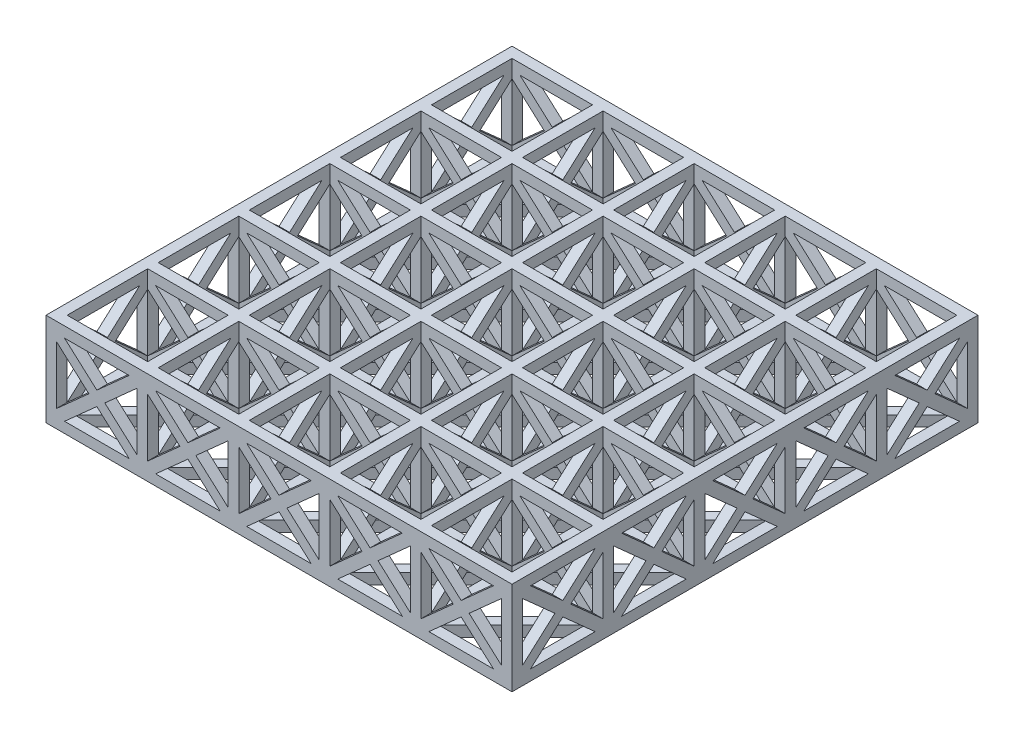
SolidWorks part; units mm, degrees
ref_plane "Front Plane" through (0, 0, 0) normal (0, 0, 1) x (1, 0, 0)
ref_plane "Top Plane" through (0, 0, 0) normal (0, 1, 0) x (1, 0, 0)
ref_plane "Right Plane" through (0, 0, 0) normal (1, 0, 0) x (0, 0, -1)
sketch "Sketch1" plane through (0, 0, 0) normal (0, 1, 0) x (1, 0, 0)
  line L1 (-44, -44) -> (44, -44)
  line L2 (-44, -44) -> (-44, 44)
  line L3 (-44, 44) -> (44, 44)
  line L4 (44, -44) -> (44, 44)
  line L5 (-44, -44) -> (44, 44) construction
  line L6 (-44, 44) -> (44, -44) construction
  point P0 (0, 0)
  dimension "D1" = 88
  dimension "D2" = 88
extrude "Boss-Extrude1" add sketch "Sketch1" along normal blind 17.6
sketch "Sketch2" plane through (0, 17.6, 0) normal (0, 1, 0) x (1, 0, 0)
  line L0 (-44, 44) -> (-44, -44) construction
  line L1 (-42, 42) -> (-26.8, 42)
  line L2 (-42, 42) -> (-42, 26.8)
  line L3 (-42, 26.8) -> (-26.8, 26.8)
  line L4 (-26.8, 42) -> (-26.8, 26.8)
  line L5 (44, 44) -> (-44, 44) construction
  line L6 (-24.8, 42) -> (-24.8, 26.8)
  line L7 (-24.8, 42) -> (-9.6, 42)
  line L8 (-9.6, 42) -> (-9.6, 26.8)
  line L9 (-24.8, 26.8) -> (-9.6, 26.8)
  line L10 (-7.6, 42) -> (-7.6, 26.8)
  line L11 (-7.6, 42) -> (7.6, 42)
  line L12 (7.6, 42) -> (7.6, 26.8)
  line L13 (-7.6, 26.8) -> (7.6, 26.8)
  line L14 (9.6, 42) -> (9.6, 26.8)
  line L15 (9.6, 42) -> (24.8, 42)
  line L16 (24.8, 42) -> (24.8, 26.8)
  line L17 (9.6, 26.8) -> (24.8, 26.8)
  line L18 (26.8, 42) -> (26.8, 26.8)
  line L19 (26.8, 42) -> (42, 42)
  line L20 (42, 42) -> (42, 26.8)
  line L21 (26.8, 26.8) -> (42, 26.8)
  line L22 (-24.8, 24.8) -> (-24.8, 9.6)
  line L23 (-24.8, 24.8) -> (-9.6, 24.8)
  line L24 (-9.6, 24.8) -> (-9.6, 9.6)
  line L25 (-24.8, 9.6) -> (-9.6, 9.6)
  line L26 (-7.6, 24.8) -> (-7.6, 9.6)
  line L27 (-7.6, 24.8) -> (7.6, 24.8)
  line L28 (7.6, 24.8) -> (7.6, 9.6)
  line L29 (-7.6, 9.6) -> (7.6, 9.6)
  line L30 (9.6, 24.8) -> (9.6, 9.6)
  line L31 (9.6, 24.8) -> (24.8, 24.8)
  line L32 (24.8, 24.8) -> (24.8, 9.6)
  line L33 (9.6, 9.6) -> (24.8, 9.6)
  line L34 (26.8, 24.8) -> (26.8, 9.6)
  line L35 (26.8, 24.8) -> (42, 24.8)
  line L36 (42, 24.8) -> (42, 9.6)
  line L37 (26.8, 9.6) -> (42, 9.6)
  line L38 (-24.8, 7.6) -> (-24.8, -7.6)
  line L39 (-24.8, 7.6) -> (-9.6, 7.6)
  line L40 (-9.6, 7.6) -> (-9.6, -7.6)
  line L41 (-24.8, -7.6) -> (-9.6, -7.6)
  line L42 (-7.6, 7.6) -> (-7.6, -7.6)
  line L43 (-7.6, 7.6) -> (7.6, 7.6)
  line L44 (7.6, 7.6) -> (7.6, -7.6)
  line L45 (-7.6, -7.6) -> (7.6, -7.6)
  line L46 (9.6, 7.6) -> (9.6, -7.6)
  line L47 (9.6, 7.6) -> (24.8, 7.6)
  line L48 (24.8, 7.6) -> (24.8, -7.6)
  line L49 (9.6, -7.6) -> (24.8, -7.6)
  line L50 (26.8, 7.6) -> (26.8, -7.6)
  line L51 (26.8, 7.6) -> (42, 7.6)
  line L52 (42, 7.6) -> (42, -7.6)
  line L53 (26.8, -7.6) -> (42, -7.6)
  line L54 (-24.8, -9.6) -> (-24.8, -24.8)
  line L55 (-24.8, -9.6) -> (-9.6, -9.6)
  line L56 (-9.6, -9.6) -> (-9.6, -24.8)
  line L57 (-24.8, -24.8) -> (-9.6, -24.8)
  line L58 (-7.6, -9.6) -> (-7.6, -24.8)
  line L59 (-7.6, -9.6) -> (7.6, -9.6)
  line L60 (7.6, -9.6) -> (7.6, -24.8)
  line L61 (-7.6, -24.8) -> (7.6, -24.8)
  line L62 (9.6, -9.6) -> (9.6, -24.8)
  line L63 (9.6, -9.6) -> (24.8, -9.6)
  line L64 (24.8, -9.6) -> (24.8, -24.8)
  line L65 (9.6, -24.8) -> (24.8, -24.8)
  line L66 (26.8, -9.6) -> (26.8, -24.8)
  line L67 (26.8, -9.6) -> (42, -9.6)
  line L68 (42, -9.6) -> (42, -24.8)
  line L69 (26.8, -24.8) -> (42, -24.8)
  line L70 (-24.8, -26.8) -> (-24.8, -42)
  line L71 (-24.8, -26.8) -> (-9.6, -26.8)
  line L72 (-9.6, -26.8) -> (-9.6, -42)
  line L73 (-24.8, -42) -> (-9.6, -42)
  line L74 (-7.6, -26.8) -> (-7.6, -42)
  line L75 (-7.6, -26.8) -> (7.6, -26.8)
  line L76 (7.6, -26.8) -> (7.6, -42)
  line L77 (-7.6, -42) -> (7.6, -42)
  line L78 (9.6, -26.8) -> (9.6, -42)
  line L79 (9.6, -26.8) -> (24.8, -26.8)
  line L80 (24.8, -26.8) -> (24.8, -42)
  line L81 (9.6, -42) -> (24.8, -42)
  line L82 (26.8, -26.8) -> (26.8, -42)
  line L83 (26.8, -26.8) -> (42, -26.8)
  line L84 (42, -26.8) -> (42, -42)
  line L85 (26.8, -42) -> (42, -42)
  line L86 (-42, 24.8) -> (-42, 9.6)
  line L87 (-42, 24.8) -> (-26.8, 24.8)
  line L88 (-26.8, 24.8) -> (-26.8, 9.6)
  line L89 (-42, 9.6) -> (-26.8, 9.6)
  line L90 (-42, 7.6) -> (-42, -7.6)
  line L91 (-42, 7.6) -> (-26.8, 7.6)
  line L92 (-26.8, 7.6) -> (-26.8, -7.6)
  line L93 (-42, -7.6) -> (-26.8, -7.6)
  line L94 (-42, -9.6) -> (-42, -24.8)
  line L95 (-42, -9.6) -> (-26.8, -9.6)
  line L96 (-26.8, -9.6) -> (-26.8, -24.8)
  line L97 (-42, -24.8) -> (-26.8, -24.8)
  line L98 (-42, -26.8) -> (-42, -42)
  line L99 (-42, -26.8) -> (-26.8, -26.8)
  line L100 (-26.8, -26.8) -> (-26.8, -42)
  line L101 (-42, -42) -> (-26.8, -42)
  dimension "D1" = 2
  dimension "D2" = 2
  dimension "D3" = 15.2
  dimension "D4" = 15.2
  dimension "D5" = 5
  dimension "D6" = 5
extrude "Cut-Extrude1" cut sketch "Sketch2" against normal blind 15.6
sketch "Sketch3" plane through (0, 0, 44) normal (0, 0, 1) x (1, 0, 0)
  line L1 (-40.5003, 2) -> (-28.2997, 2)
  line L2 (-42, 3.3418) -> (-42, 14.2582)
  line L3 (-40.5003, 15.6) -> (-28.2997, 15.6)
  line L4 (-26.8, 3.3418) -> (-26.8, 14.2582)
  line L7 (-23.3003, 2) -> (-11.0997, 2)
  line L8 (-17.2, 7.4582) -> (-11.0997, 2)
  line L9 (-42, 14.2582) -> (-35.8997, 8.8)
  line L10 (-28.2997, 15.6) -> (-34.4, 10.1418)
  line L11 (-40.5003, 15.6) -> (-34.4, 10.1418)
  line L12 (-26.8, 14.2582) -> (-32.9003, 8.8)
  line L13 (-17.2, 7.4582) -> (-23.3003, 2)
  line L14 (-24.8, 3.3418) -> (-24.8, 14.2582)
  line L15 (-24.8, 14.2582) -> (-18.6997, 8.8)
  line L16 (-18.6997, 8.8) -> (-24.8, 3.3418)
  line L17 (-23.3003, 15.6) -> (-11.0997, 15.6)
  line L18 (-11.0997, 15.6) -> (-17.2, 10.1418)
  line L19 (-34.4, 7.4582) -> (-28.2997, 2)
  line L20 (-35.8997, 8.8) -> (-42, 3.3418)
  line L21 (-34.4, 7.4582) -> (-40.5003, 2)
  line L22 (-32.9003, 8.8) -> (-26.8, 3.3418)
  line L23 (-23.3003, 15.6) -> (-17.2, 10.1418)
  line L24 (-9.6, 3.3418) -> (-9.6, 14.2582)
  line L25 (-9.6, 14.2582) -> (-15.7003, 8.8)
  line L26 (-15.7003, 8.8) -> (-9.6, 3.3418)
  line L27 (-6.1003, 2) -> (6.1003, 2)
  line L28 (0, 7.4582) -> (6.1003, 2)
  line L29 (0, 7.4582) -> (-6.1003, 2)
  line L30 (-7.6, 3.3418) -> (-7.6, 14.2582)
  line L31 (-7.6, 14.2582) -> (-1.4997, 8.8)
  line L32 (-1.4997, 8.8) -> (-7.6, 3.3418)
  line L33 (-6.1003, 15.6) -> (6.1003, 15.6)
  line L34 (6.1003, 15.6) -> (0, 10.1418)
  line L35 (-6.1003, 15.6) -> (0, 10.1418)
  line L36 (7.6, 3.3418) -> (7.6, 14.2582)
  line L37 (7.6, 14.2582) -> (1.4997, 8.8)
  line L38 (1.4997, 8.8) -> (7.6, 3.3418)
  line L39 (11.0997, 2) -> (23.3003, 2)
  line L40 (17.2, 7.4582) -> (23.3003, 2)
  line L41 (17.2, 7.4582) -> (11.0997, 2)
  line L42 (9.6, 3.3418) -> (9.6, 14.2582)
  line L43 (9.6, 14.2582) -> (15.7003, 8.8)
  line L44 (15.7003, 8.8) -> (9.6, 3.3418)
  line L45 (11.0997, 15.6) -> (23.3003, 15.6)
  line L46 (23.3003, 15.6) -> (17.2, 10.1418)
  line L47 (11.0997, 15.6) -> (17.2, 10.1418)
  line L48 (24.8, 3.3418) -> (24.8, 14.2582)
  line L49 (24.8, 14.2582) -> (18.6997, 8.8)
  line L50 (18.6997, 8.8) -> (24.8, 3.3418)
  line L51 (28.2997, 2) -> (40.5003, 2)
  line L52 (34.4, 7.4582) -> (40.5003, 2)
  line L53 (34.4, 7.4582) -> (28.2997, 2)
  line L54 (26.8, 3.3418) -> (26.8, 14.2582)
  line L55 (26.8, 14.2582) -> (32.9003, 8.8)
  line L56 (32.9003, 8.8) -> (26.8, 3.3418)
  line L57 (28.2997, 15.6) -> (40.5003, 15.6)
  line L58 (40.5003, 15.6) -> (34.4, 10.1418)
  line L59 (28.2997, 15.6) -> (34.4, 10.1418)
  line L60 (42, 3.3418) -> (42, 14.2582)
  line L61 (42, 14.2582) -> (35.8997, 8.8)
  line L62 (35.8997, 8.8) -> (42, 3.3418)
  point P1 (-89.8557, 20.9335)
  dimension "D5" = 5
extrude "Cut-Extrude2" cut sketch "Sketch3" against normal through all
sketch "Sketch4" plane through (44, 0, 0) normal (1, 0, 0) x (0, 0, -1)
  line L1 (-40.5003, 2) -> (-28.2997, 2)
  line L2 (-42, 3.3418) -> (-42, 14.2582)
  line L3 (-40.5003, 15.6) -> (-28.2997, 15.6)
  line L4 (-26.8, 3.3418) -> (-26.8, 14.2582)
  line L7 (-23.3003, 15.6) -> (-11.0997, 15.6)
  line L8 (-17.2, 10.1418) -> (-11.0997, 15.6)
  line L9 (-42, 14.2582) -> (-35.8997, 8.8)
  line L10 (-40.5003, 2) -> (-34.4, 7.4582)
  line L11 (-40.5003, 15.6) -> (-34.4, 10.1418)
  line L12 (-42, 3.3418) -> (-35.8997, 8.8)
  line L13 (-23.3003, 15.6) -> (-17.2, 10.1418)
  line L14 (-24.8, 3.3418) -> (-24.8, 14.2582)
  line L15 (-24.8, 14.2582) -> (-18.6997, 8.8)
  line L16 (-24.8, 3.3418) -> (-18.6997, 8.8)
  line L17 (-23.3003, 2) -> (-11.0997, 2)
  line L18 (-17.2, 7.4582) -> (-11.0997, 2)
  line L19 (-32.9003, 8.8) -> (-26.8, 3.3418)
  line L20 (-34.4, 7.4582) -> (-28.2997, 2)
  line L21 (-34.4, 10.1418) -> (-28.2997, 15.6)
  line L22 (-32.9003, 8.8) -> (-26.8, 14.2582)
  line L23 (-23.3003, 2) -> (-17.2, 7.4582)
  line L24 (-9.6, 3.3418) -> (-9.6, 14.2582)
  line L25 (-15.7003, 8.8) -> (-9.6, 14.2582)
  line L26 (-15.7003, 8.8) -> (-9.6, 3.3418)
  line L27 (-6.1003, 15.6) -> (6.1003, 15.6)
  line L28 (0, 10.1418) -> (6.1003, 15.6)
  line L29 (-6.1003, 15.6) -> (0, 10.1418)
  line L30 (-7.6, 3.3418) -> (-7.6, 14.2582)
  line L31 (-7.6, 14.2582) -> (-1.4997, 8.8)
  line L32 (-7.6, 3.3418) -> (-1.4997, 8.8)
  line L33 (-6.1003, 2) -> (6.1003, 2)
  line L34 (0, 7.4582) -> (6.1003, 2)
  line L35 (-6.1003, 2) -> (0, 7.4582)
  line L36 (7.6, 3.3418) -> (7.6, 14.2582)
  line L37 (1.4997, 8.8) -> (7.6, 14.2582)
  line L38 (1.4997, 8.8) -> (7.6, 3.3418)
  line L39 (11.0997, 15.6) -> (23.3003, 15.6)
  line L40 (17.2, 10.1418) -> (23.3003, 15.6)
  line L41 (11.0997, 15.6) -> (17.2, 10.1418)
  line L42 (9.6, 3.3418) -> (9.6, 14.2582)
  line L43 (9.6, 14.2582) -> (15.7003, 8.8)
  line L44 (9.6, 3.3418) -> (15.7003, 8.8)
  line L45 (11.0997, 2) -> (23.3003, 2)
  line L46 (17.2, 7.4582) -> (23.3003, 2)
  line L47 (11.0997, 2) -> (17.2, 7.4582)
  line L48 (24.8, 3.3418) -> (24.8, 14.2582)
  line L49 (18.6997, 8.8) -> (24.8, 14.2582)
  line L50 (18.6997, 8.8) -> (24.8, 3.3418)
  line L51 (28.2997, 15.6) -> (40.5003, 15.6)
  line L52 (34.4, 10.1418) -> (40.5003, 15.6)
  line L53 (28.2997, 15.6) -> (34.4, 10.1418)
  line L54 (26.8, 3.3418) -> (26.8, 14.2582)
  line L55 (26.8, 14.2582) -> (32.9003, 8.8)
  line L56 (26.8, 3.3418) -> (32.9003, 8.8)
  line L57 (28.2997, 2) -> (40.5003, 2)
  line L58 (34.4, 7.4582) -> (40.5003, 2)
  line L59 (28.2997, 2) -> (34.4, 7.4582)
  line L60 (42, 3.3418) -> (42, 14.2582)
  line L61 (35.8997, 8.8) -> (42, 14.2582)
  line L62 (35.8997, 8.8) -> (42, 3.3418)
  point P0 (-61.3961, 32.3336)
  dimension "D5" = 5
extrude "Cut-Extrude3" cut sketch "Sketch4" against normal through all
sketch "Sketch5" plane through (0, 0, 0) normal (0, -1, 0) x (1, 0, 0)
  line L1 (-40.5858, 42) -> (-28.2142, 42)
  line L2 (-42, 40.5858) -> (-42, 28.2142)
  line L3 (-40.5858, 26.8) -> (-28.2142, 26.8)
  line L4 (-26.8, 40.5858) -> (-26.8, 28.2142)
  line L6 (-23.3858, 42) -> (-11.0142, 42)
  line L7 (-24.8, 40.5858) -> (-24.8, 28.2142)
  line L8 (-42, 40.5858) -> (-35.8142, 34.4)
  line L9 (-40.5858, 26.8) -> (-34.4, 32.9858)
  line L10 (-40.5858, 42) -> (-34.4, 35.8142)
  line L11 (-42, 28.2142) -> (-35.8142, 34.4)
  line L12 (-23.3858, 26.8) -> (-11.0142, 26.8)
  line L13 (-9.6, 40.5858) -> (-9.6, 28.2142)
  line L14 (-24.8, 40.5858) -> (-18.6142, 34.4)
  line L15 (-23.3858, 26.8) -> (-17.2, 32.9858)
  line L16 (-23.3858, 42) -> (-17.2, 35.8142)
  line L17 (-24.8, 28.2142) -> (-18.6142, 34.4)
  line L18 (-32.9858, 34.4) -> (-26.8, 28.2142)
  line L19 (-34.4, 35.8142) -> (-28.2142, 42)
  line L20 (-34.4, 32.9858) -> (-28.2142, 26.8)
  line L21 (-32.9858, 34.4) -> (-26.8, 40.5858)
  line L22 (-15.7858, 34.4) -> (-9.6, 28.2142)
  line L23 (-17.2, 35.8142) -> (-11.0142, 42)
  line L24 (-17.2, 32.9858) -> (-11.0142, 26.8)
  line L25 (-15.7858, 34.4) -> (-9.6, 40.5858)
  line L26 (-6.1858, 42) -> (6.1858, 42)
  line L27 (-7.6, 40.5858) -> (-7.6, 28.2142)
  line L28 (-6.1858, 26.8) -> (6.1858, 26.8)
  line L29 (7.6, 40.5858) -> (7.6, 28.2142)
  line L30 (-7.6, 40.5858) -> (-1.4142, 34.4)
  line L31 (-6.1858, 26.8) -> (0, 32.9858)
  line L32 (-6.1858, 42) -> (0, 35.8142)
  line L33 (-7.6, 28.2142) -> (-1.4142, 34.4)
  line L34 (1.4142, 34.4) -> (7.6, 28.2142)
  line L35 (0, 35.8142) -> (6.1858, 42)
  line L36 (0, 32.9858) -> (6.1858, 26.8)
  line L37 (1.4142, 34.4) -> (7.6, 40.5858)
  line L38 (11.0142, 42) -> (23.3858, 42)
  line L39 (9.6, 40.5858) -> (9.6, 28.2142)
  line L40 (11.0142, 26.8) -> (23.3858, 26.8)
  line L41 (24.8, 40.5858) -> (24.8, 28.2142)
  line L42 (9.6, 40.5858) -> (15.7858, 34.4)
  line L43 (11.0142, 26.8) -> (17.2, 32.9858)
  line L44 (11.0142, 42) -> (17.2, 35.8142)
  line L45 (9.6, 28.2142) -> (15.7858, 34.4)
  line L46 (18.6142, 34.4) -> (24.8, 28.2142)
  line L47 (17.2, 35.8142) -> (23.3858, 42)
  line L48 (17.2, 32.9858) -> (23.3858, 26.8)
  line L49 (18.6142, 34.4) -> (24.8, 40.5858)
  line L50 (28.2142, 42) -> (40.5858, 42)
  line L51 (26.8, 40.5858) -> (26.8, 28.2142)
  line L52 (28.2142, 26.8) -> (40.5858, 26.8)
  line L53 (42, 40.5858) -> (42, 28.2142)
  line L54 (26.8, 40.5858) -> (32.9858, 34.4)
  line L55 (28.2142, 26.8) -> (34.4, 32.9858)
  line L56 (28.2142, 42) -> (34.4, 35.8142)
  line L57 (26.8, 28.2142) -> (32.9858, 34.4)
  line L58 (35.8142, 34.4) -> (42, 28.2142)
  line L59 (34.4, 35.8142) -> (40.5858, 42)
  line L60 (34.4, 32.9858) -> (40.5858, 26.8)
  line L61 (35.8142, 34.4) -> (42, 40.5858)
  line L62 (-23.3858, 24.8) -> (-11.0142, 24.8)
  line L63 (-24.8, 23.3858) -> (-24.8, 11.0142)
  line L64 (-23.3858, 9.6) -> (-11.0142, 9.6)
  line L65 (-9.6, 23.3858) -> (-9.6, 11.0142)
  line L66 (-24.8, 23.3858) -> (-18.6142, 17.2)
  line L67 (-23.3858, 9.6) -> (-17.2, 15.7858)
  line L68 (-23.3858, 24.8) -> (-17.2, 18.6142)
  line L69 (-24.8, 11.0142) -> (-18.6142, 17.2)
  line L70 (-15.7858, 17.2) -> (-9.6, 11.0142)
  line L71 (-17.2, 18.6142) -> (-11.0142, 24.8)
  line L72 (-17.2, 15.7858) -> (-11.0142, 9.6)
  line L73 (-15.7858, 17.2) -> (-9.6, 23.3858)
  line L74 (-6.1858, 24.8) -> (6.1858, 24.8)
  line L75 (-7.6, 23.3858) -> (-7.6, 11.0142)
  line L76 (-6.1858, 9.6) -> (6.1858, 9.6)
  line L77 (7.6, 23.3858) -> (7.6, 11.0142)
  line L78 (-7.6, 23.3858) -> (-1.4142, 17.2)
  line L79 (-6.1858, 9.6) -> (0, 15.7858)
  line L80 (-6.1858, 24.8) -> (0, 18.6142)
  line L81 (-7.6, 11.0142) -> (-1.4142, 17.2)
  line L82 (1.4142, 17.2) -> (7.6, 11.0142)
  line L83 (0, 18.6142) -> (6.1858, 24.8)
  line L84 (0, 15.7858) -> (6.1858, 9.6)
  line L85 (1.4142, 17.2) -> (7.6, 23.3858)
  line L86 (11.0142, 24.8) -> (23.3858, 24.8)
  line L87 (9.6, 23.3858) -> (9.6, 11.0142)
  line L88 (11.0142, 9.6) -> (23.3858, 9.6)
  line L89 (24.8, 23.3858) -> (24.8, 11.0142)
  line L90 (9.6, 23.3858) -> (15.7858, 17.2)
  line L91 (11.0142, 9.6) -> (17.2, 15.7858)
  line L92 (11.0142, 24.8) -> (17.2, 18.6142)
  line L93 (9.6, 11.0142) -> (15.7858, 17.2)
  line L94 (18.6142, 17.2) -> (24.8, 11.0142)
  line L95 (17.2, 18.6142) -> (23.3858, 24.8)
  line L96 (17.2, 15.7858) -> (23.3858, 9.6)
  line L97 (18.6142, 17.2) -> (24.8, 23.3858)
  line L98 (28.2142, 24.8) -> (40.5858, 24.8)
  line L99 (26.8, 23.3858) -> (26.8, 11.0142)
  line L100 (28.2142, 9.6) -> (40.5858, 9.6)
  line L101 (42, 23.3858) -> (42, 11.0142)
  line L102 (26.8, 23.3858) -> (32.9858, 17.2)
  line L103 (28.2142, 9.6) -> (34.4, 15.7858)
  line L104 (28.2142, 24.8) -> (34.4, 18.6142)
  line L105 (26.8, 11.0142) -> (32.9858, 17.2)
  line L106 (35.8142, 17.2) -> (42, 11.0142)
  line L107 (34.4, 18.6142) -> (40.5858, 24.8)
  line L108 (34.4, 15.7858) -> (40.5858, 9.6)
  line L109 (35.8142, 17.2) -> (42, 23.3858)
  line L110 (-23.3858, 7.6) -> (-11.0142, 7.6)
  line L111 (-24.8, 6.1858) -> (-24.8, -6.1858)
  line L112 (-23.3858, -7.6) -> (-11.0142, -7.6)
  line L113 (-9.6, 6.1858) -> (-9.6, -6.1858)
  line L114 (-24.8, 6.1858) -> (-18.6142, 0)
  line L115 (-23.3858, -7.6) -> (-17.2, -1.4142)
  line L116 (-23.3858, 7.6) -> (-17.2, 1.4142)
  line L117 (-24.8, -6.1858) -> (-18.6142, 0)
  line L118 (-15.7858, 0) -> (-9.6, -6.1858)
  line L119 (-17.2, 1.4142) -> (-11.0142, 7.6)
  line L120 (-17.2, -1.4142) -> (-11.0142, -7.6)
  line L121 (-15.7858, 0) -> (-9.6, 6.1858)
  line L122 (-6.1858, 7.6) -> (6.1858, 7.6)
  line L123 (-7.6, 6.1858) -> (-7.6, -6.1858)
  line L124 (-6.1858, -7.6) -> (6.1858, -7.6)
  line L125 (7.6, 6.1858) -> (7.6, -6.1858)
  line L126 (-7.6, 6.1858) -> (-1.4142, 0)
  line L127 (-6.1858, -7.6) -> (0, -1.4142)
  line L128 (-6.1858, 7.6) -> (0, 1.4142)
  line L129 (-7.6, -6.1858) -> (-1.4142, 0)
  line L130 (1.4142, 0) -> (7.6, -6.1858)
  line L131 (0, 1.4142) -> (6.1858, 7.6)
  line L132 (0, -1.4142) -> (6.1858, -7.6)
  line L133 (1.4142, 0) -> (7.6, 6.1858)
  line L134 (11.0142, 7.6) -> (23.3858, 7.6)
  line L135 (9.6, 6.1858) -> (9.6, -6.1858)
  line L136 (11.0142, -7.6) -> (23.3858, -7.6)
  line L137 (24.8, 6.1858) -> (24.8, -6.1858)
  line L138 (9.6, 6.1858) -> (15.7858, 0)
  line L139 (11.0142, -7.6) -> (17.2, -1.4142)
  line L140 (11.0142, 7.6) -> (17.2, 1.4142)
  line L141 (9.6, -6.1858) -> (15.7858, 0)
  line L142 (18.6142, 0) -> (24.8, -6.1858)
  line L143 (17.2, 1.4142) -> (23.3858, 7.6)
  line L144 (17.2, -1.4142) -> (23.3858, -7.6)
  line L145 (18.6142, 0) -> (24.8, 6.1858)
  line L146 (28.2142, 7.6) -> (40.5858, 7.6)
  line L147 (26.8, 6.1858) -> (26.8, -6.1858)
  line L148 (28.2142, -7.6) -> (40.5858, -7.6)
  line L149 (42, 6.1858) -> (42, -6.1858)
  line L150 (26.8, 6.1858) -> (32.9858, 0)
  line L151 (28.2142, -7.6) -> (34.4, -1.4142)
  line L152 (28.2142, 7.6) -> (34.4, 1.4142)
  line L153 (26.8, -6.1858) -> (32.9858, 0)
  line L154 (35.8142, 0) -> (42, -6.1858)
  line L155 (34.4, 1.4142) -> (40.5858, 7.6)
  line L156 (34.4, -1.4142) -> (40.5858, -7.6)
  line L157 (35.8142, 0) -> (42, 6.1858)
  line L158 (-23.3858, -9.6) -> (-11.0142, -9.6)
  line L159 (-24.8, -11.0142) -> (-24.8, -23.3858)
  line L160 (-23.3858, -24.8) -> (-11.0142, -24.8)
  line L161 (-9.6, -11.0142) -> (-9.6, -23.3858)
  line L162 (-24.8, -11.0142) -> (-18.6142, -17.2)
  line L163 (-23.3858, -24.8) -> (-17.2, -18.6142)
  line L164 (-23.3858, -9.6) -> (-17.2, -15.7858)
  line L165 (-24.8, -23.3858) -> (-18.6142, -17.2)
  line L166 (-15.7858, -17.2) -> (-9.6, -23.3858)
  line L167 (-17.2, -15.7858) -> (-11.0142, -9.6)
  line L168 (-17.2, -18.6142) -> (-11.0142, -24.8)
  line L169 (-15.7858, -17.2) -> (-9.6, -11.0142)
  line L170 (-6.1858, -9.6) -> (6.1858, -9.6)
  line L171 (-7.6, -11.0142) -> (-7.6, -23.3858)
  line L172 (-6.1858, -24.8) -> (6.1858, -24.8)
  line L173 (7.6, -11.0142) -> (7.6, -23.3858)
  line L174 (-7.6, -11.0142) -> (-1.4142, -17.2)
  line L175 (-6.1858, -24.8) -> (0, -18.6142)
  line L176 (-6.1858, -9.6) -> (0, -15.7858)
  line L177 (-7.6, -23.3858) -> (-1.4142, -17.2)
  line L178 (1.4142, -17.2) -> (7.6, -23.3858)
  line L179 (0, -15.7858) -> (6.1858, -9.6)
  line L180 (0, -18.6142) -> (6.1858, -24.8)
  line L181 (1.4142, -17.2) -> (7.6, -11.0142)
  line L182 (11.0142, -9.6) -> (23.3858, -9.6)
  line L183 (9.6, -11.0142) -> (9.6, -23.3858)
  line L184 (11.0142, -24.8) -> (23.3858, -24.8)
  line L185 (24.8, -11.0142) -> (24.8, -23.3858)
  line L186 (9.6, -11.0142) -> (15.7858, -17.2)
  line L187 (11.0142, -24.8) -> (17.2, -18.6142)
  line L188 (11.0142, -9.6) -> (17.2, -15.7858)
  line L189 (9.6, -23.3858) -> (15.7858, -17.2)
  line L190 (18.6142, -17.2) -> (24.8, -23.3858)
  line L191 (17.2, -15.7858) -> (23.3858, -9.6)
  line L192 (17.2, -18.6142) -> (23.3858, -24.8)
  line L193 (18.6142, -17.2) -> (24.8, -11.0142)
  line L194 (28.2142, -9.6) -> (40.5858, -9.6)
  line L195 (26.8, -11.0142) -> (26.8, -23.3858)
  line L196 (28.2142, -24.8) -> (40.5858, -24.8)
  line L197 (42, -11.0142) -> (42, -23.3858)
  line L198 (26.8, -11.0142) -> (32.9858, -17.2)
  line L199 (28.2142, -24.8) -> (34.4, -18.6142)
  line L200 (28.2142, -9.6) -> (34.4, -15.7858)
  line L201 (26.8, -23.3858) -> (32.9858, -17.2)
  line L202 (35.8142, -17.2) -> (42, -23.3858)
  line L203 (34.4, -15.7858) -> (40.5858, -9.6)
  line L204 (34.4, -18.6142) -> (40.5858, -24.8)
  line L205 (35.8142, -17.2) -> (42, -11.0142)
  line L206 (-23.3858, -26.8) -> (-11.0142, -26.8)
  line L207 (-24.8, -28.2142) -> (-24.8, -40.5858)
  line L208 (-23.3858, -42) -> (-11.0142, -42)
  line L209 (-9.6, -28.2142) -> (-9.6, -40.5858)
  line L210 (-24.8, -28.2142) -> (-18.6142, -34.4)
  line L211 (-23.3858, -42) -> (-17.2, -35.8142)
  line L212 (-23.3858, -26.8) -> (-17.2, -32.9858)
  line L213 (-24.8, -40.5858) -> (-18.6142, -34.4)
  line L214 (-15.7858, -34.4) -> (-9.6, -40.5858)
  line L215 (-17.2, -32.9858) -> (-11.0142, -26.8)
  line L216 (-17.2, -35.8142) -> (-11.0142, -42)
  line L217 (-15.7858, -34.4) -> (-9.6, -28.2142)
  line L218 (-6.1858, -26.8) -> (6.1858, -26.8)
  line L219 (-7.6, -28.2142) -> (-7.6, -40.5858)
  line L220 (-6.1858, -42) -> (6.1858, -42)
  line L221 (7.6, -28.2142) -> (7.6, -40.5858)
  line L222 (-7.6, -28.2142) -> (-1.4142, -34.4)
  line L223 (-6.1858, -42) -> (0, -35.8142)
  line L224 (-6.1858, -26.8) -> (0, -32.9858)
  line L225 (-7.6, -40.5858) -> (-1.4142, -34.4)
  line L226 (1.4142, -34.4) -> (7.6, -40.5858)
  line L227 (0, -32.9858) -> (6.1858, -26.8)
  line L228 (0, -35.8142) -> (6.1858, -42)
  line L229 (1.4142, -34.4) -> (7.6, -28.2142)
  line L230 (11.0142, -26.8) -> (23.3858, -26.8)
  line L231 (9.6, -28.2142) -> (9.6, -40.5858)
  line L232 (11.0142, -42) -> (23.3858, -42)
  line L233 (24.8, -28.2142) -> (24.8, -40.5858)
  line L234 (9.6, -28.2142) -> (15.7858, -34.4)
  line L235 (11.0142, -42) -> (17.2, -35.8142)
  line L236 (11.0142, -26.8) -> (17.2, -32.9858)
  line L237 (9.6, -40.5858) -> (15.7858, -34.4)
  line L238 (18.6142, -34.4) -> (24.8, -40.5858)
  line L239 (17.2, -32.9858) -> (23.3858, -26.8)
  line L240 (17.2, -35.8142) -> (23.3858, -42)
  line L241 (18.6142, -34.4) -> (24.8, -28.2142)
  line L242 (28.2142, -26.8) -> (40.5858, -26.8)
  line L243 (26.8, -28.2142) -> (26.8, -40.5858)
  line L244 (28.2142, -42) -> (40.5858, -42)
  line L245 (42, -28.2142) -> (42, -40.5858)
  line L246 (26.8, -28.2142) -> (32.9858, -34.4)
  line L247 (28.2142, -42) -> (34.4, -35.8142)
  line L248 (28.2142, -26.8) -> (34.4, -32.9858)
  line L249 (26.8, -40.5858) -> (32.9858, -34.4)
  line L250 (35.8142, -34.4) -> (42, -40.5858)
  line L251 (34.4, -32.9858) -> (40.5858, -26.8)
  line L252 (34.4, -35.8142) -> (40.5858, -42)
  line L253 (35.8142, -34.4) -> (42, -28.2142)
  line L254 (-40.5858, 24.8) -> (-28.2142, 24.8)
  line L255 (-42, 23.3858) -> (-42, 11.0142)
  line L256 (-40.5858, 9.6) -> (-28.2142, 9.6)
  line L257 (-26.8, 23.3858) -> (-26.8, 11.0142)
  line L258 (-42, 23.3858) -> (-35.8142, 17.2)
  line L259 (-40.5858, 9.6) -> (-34.4, 15.7858)
  line L260 (-40.5858, 24.8) -> (-34.4, 18.6142)
  line L261 (-42, 11.0142) -> (-35.8142, 17.2)
  line L262 (-32.9858, 17.2) -> (-26.8, 11.0142)
  line L263 (-34.4, 18.6142) -> (-28.2142, 24.8)
  line L264 (-34.4, 15.7858) -> (-28.2142, 9.6)
  line L265 (-32.9858, 17.2) -> (-26.8, 23.3858)
  line L266 (-40.5858, 7.6) -> (-28.2142, 7.6)
  line L267 (-42, 6.1858) -> (-42, -6.1858)
  line L268 (-40.5858, -7.6) -> (-28.2142, -7.6)
  line L269 (-26.8, 6.1858) -> (-26.8, -6.1858)
  line L270 (-42, 6.1858) -> (-35.8142, 0)
  line L271 (-40.5858, -7.6) -> (-34.4, -1.4142)
  line L272 (-40.5858, 7.6) -> (-34.4, 1.4142)
  line L273 (-42, -6.1858) -> (-35.8142, 0)
  line L274 (-32.9858, 0) -> (-26.8, -6.1858)
  line L275 (-34.4, 1.4142) -> (-28.2142, 7.6)
  line L276 (-34.4, -1.4142) -> (-28.2142, -7.6)
  line L277 (-32.9858, 0) -> (-26.8, 6.1858)
  line L278 (-40.5858, -9.6) -> (-28.2142, -9.6)
  line L279 (-42, -11.0142) -> (-42, -23.3858)
  line L280 (-40.5858, -24.8) -> (-28.2142, -24.8)
  line L281 (-26.8, -11.0142) -> (-26.8, -23.3858)
  line L282 (-42, -11.0142) -> (-35.8142, -17.2)
  line L283 (-40.5858, -24.8) -> (-34.4, -18.6142)
  line L284 (-40.5858, -9.6) -> (-34.4, -15.7858)
  line L285 (-42, -23.3858) -> (-35.8142, -17.2)
  line L286 (-32.9858, -17.2) -> (-26.8, -23.3858)
  line L287 (-34.4, -15.7858) -> (-28.2142, -9.6)
  line L288 (-34.4, -18.6142) -> (-28.2142, -24.8)
  line L289 (-32.9858, -17.2) -> (-26.8, -11.0142)
  line L290 (-40.5858, -26.8) -> (-28.2142, -26.8)
  line L291 (-42, -28.2142) -> (-42, -40.5858)
  line L292 (-40.5858, -42) -> (-28.2142, -42)
  line L293 (-26.8, -28.2142) -> (-26.8, -40.5858)
  line L294 (-42, -28.2142) -> (-35.8142, -34.4)
  line L295 (-40.5858, -42) -> (-34.4, -35.8142)
  line L296 (-40.5858, -26.8) -> (-34.4, -32.9858)
  line L297 (-42, -40.5858) -> (-35.8142, -34.4)
  line L298 (-32.9858, -34.4) -> (-26.8, -40.5858)
  line L299 (-34.4, -32.9858) -> (-28.2142, -26.8)
  line L300 (-34.4, -35.8142) -> (-28.2142, -42)
  line L301 (-32.9858, -34.4) -> (-26.8, -28.2142)
  point P0 (-75.1148, 16.2919)
  dimension "D3" = 5
  dimension "D4" = 5
extrude "Cut-Extrude4" cut sketch "Sketch5" against normal through all
